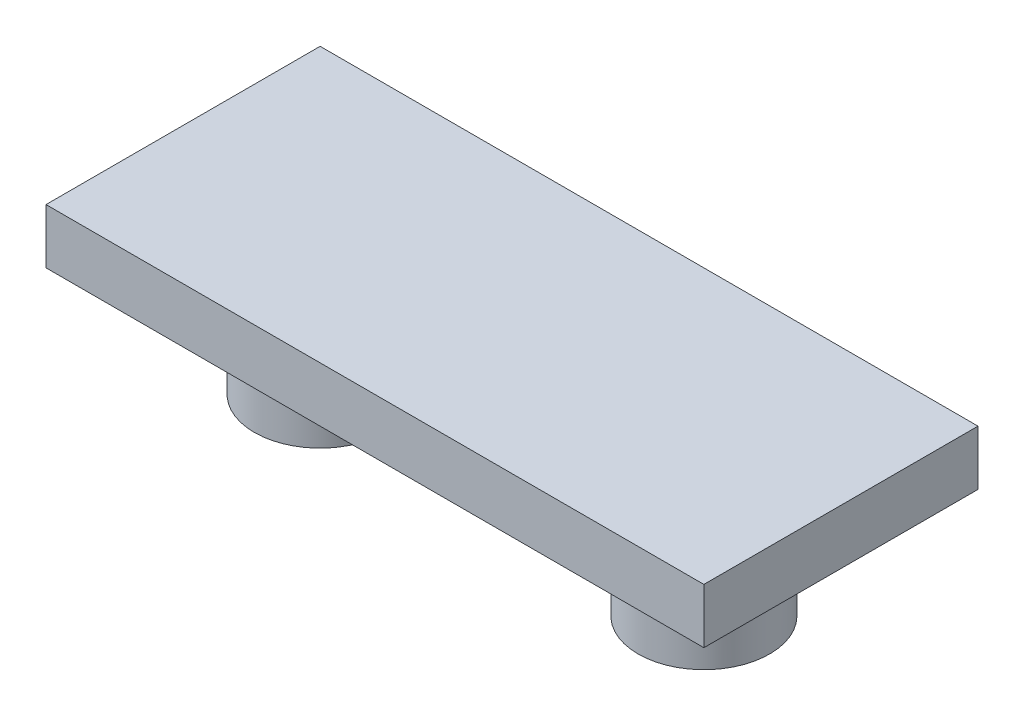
SolidWorks part; units mm, degrees
ref_plane "前视基准面" through (0, 0, 0) normal (0, 0, 1) x (1, 0, 0)
ref_plane "上视基准面" through (0, 0, 0) normal (0, 1, 0) x (1, 0, 0)
ref_plane "右视基准面" through (0, 0, 0) normal (1, 0, 0) x (0, 0, -1)
other "Configuration Table"
sketch "BaseSk" plane through (0, 0, 0) normal (0, 1, 0) x (1, 0, 0)
  line L1 (0, 0) -> (120, 0)
  line L2 (0, 0) -> (0, 50)
  line L3 (0, 50) -> (120, 50)
  line L4 (120, 0) -> (120, 50)
extrude "BaseBoss" add sketch "BaseSk" against normal blind 10
sketch "PillarASk" plane through (0, 0, 0) normal (0, 1, 0) x (1, 0, 0)
  circle A0 centre (25, 25) radius 12
sketch "PillarBSk" plane through (0, 0, 0) normal (0, 1, 0) x (1, 0, 0)
  circle A0 centre (95, 25) radius 12
extrude "PillarABoss" add sketch "PillarASk" against normal blind 30
extrude "PillarBBoss" add sketch "PillarBSk" against normal blind 30
